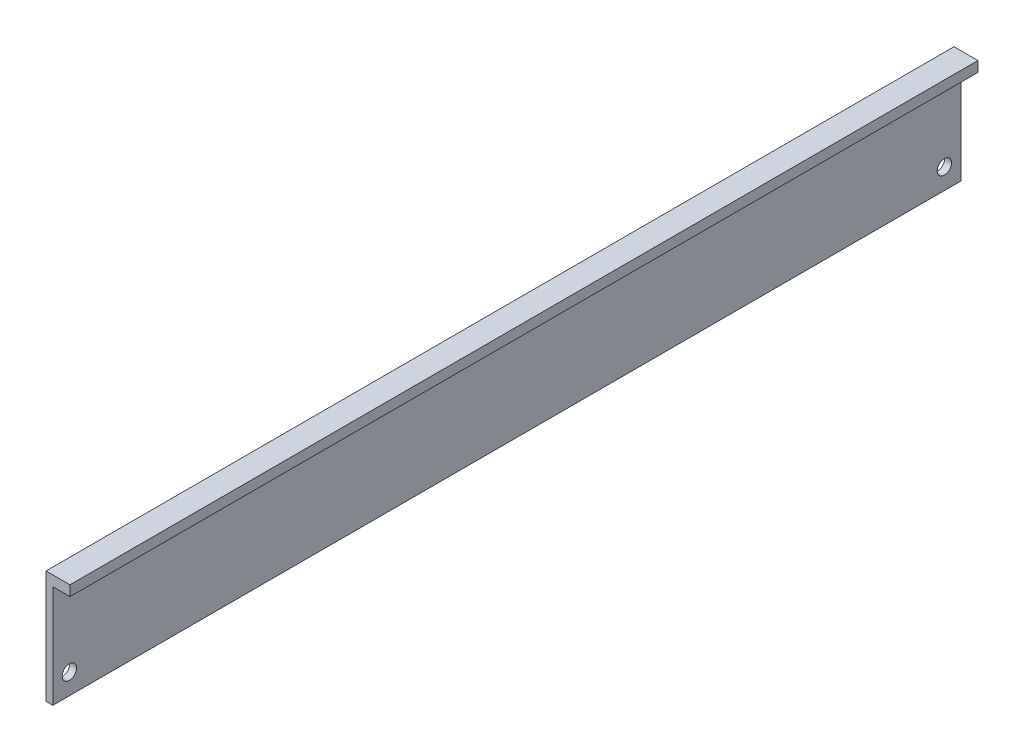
SolidWorks part; units mm, degrees
ref_plane "前视基准面" through (0, 0, 0) normal (0, 0, 1) x (1, 0, 0)
ref_plane "上视基准面" through (0, 0, 0) normal (0, 1, 0) x (1, 0, 0)
ref_plane "右视基准面" through (0, 0, 0) normal (1, 0, 0) x (0, 0, -1)
ref_plane "基准面1" through (4153.3665, 0, 0) normal (1, 0, 0) x (0, 0, -1)
sketch "草图1" plane through (4153.3665, 0, 0) normal (1, 0, 0) x (0, 0, -1)
  line L0 (132, 1662.2659) -> (132, 1695.2659)
  line L1 (132, 1695.2659) -> (0, 1695.2659)
  line L2 (0, 1695.2659) -> (0, 1662.2659)
  line L3 (0, 1662.2659) -> (132, 1662.2659)
extrude "凸台-拉伸1" add sketch "草图1" against normal blind 7
sketch "草图2" plane through (0, 0, -132) normal (0, 0, -1) x (-1, 0, 0)
  line L0 (-4148.3665, 1692.2659) -> (-4153.3665, 1692.2659)
  line L1 (-4153.3665, 1692.2659) -> (-4153.3665, 1662.2659)
  line L2 (-4153.3665, 1662.2659) -> (-4148.3665, 1662.2659)
  line L3 (-4148.3665, 1662.2659) -> (-4148.3665, 1692.2659)
extrude "切除-拉伸1" cut sketch "草图2" against normal through all
hole_wizard "Ø4.2 (4.2) 直径孔1" positions "草图4" profile "草图3" hole size "Ø4.2" standard "ANSI Metric"
sketch "草图4" plane through (4146.3665, 0, 0) normal (-1, 0, 0) x (0, 0, 1)
  point P0 (-127.175, 1668.2659)
sketch "草图3" plane through (4146.3665, 1668.2659, -127.175) normal (0, 1, 0) x (0, 0, 1)
  line L0 (0, 0) -> (0, 7)
  line L1 (0, 7) -> (2.1, 7)
  line L2 (2.1, 7) -> (2.1, 0)
  line L5 (2.1, 0) -> (0, 0)
  line L11 (0, -6.35) -> (0, 107.95) construction
  dimension "通孔孔直径" = 4.2
  dimension "通孔孔深度" = 7
sketch "草图5" plane through (0, 0, 0) normal (0, 0, 1) x (1, 0, 0)
  line L6 (4148.3665, 1662.2659) -> (4148.3665, 1692.2659)
  line L7 (4148.3665, 1692.2659) -> (4153.3665, 1692.2659)
  line L8 (4153.3665, 1692.2659) -> (4153.3665, 1695.2659)
  line L9 (4153.3665, 1695.2659) -> (4146.3665, 1695.2659)
  line L10 (4146.3665, 1695.2659) -> (4146.3665, 1662.2659)
  line L11 (4146.3665, 1662.2659) -> (4148.3665, 1662.2659)
  line L12 (4148.3665, 1662.2659) -> (4148.3665, 1692.2659)
  line L13 (4148.3665, 1692.2659) -> (4153.3665, 1692.2659)
  line L14 (4153.3665, 1692.2659) -> (4153.3665, 1695.2659)
  line L15 (4153.3665, 1695.2659) -> (4146.3665, 1695.2659)
  line L16 (4146.3665, 1695.2659) -> (4146.3665, 1662.2659)
  line L17 (4146.3665, 1662.2659) -> (4148.3665, 1662.2659)
  dimension "D1" = 0
extrude "凸台-拉伸2" add sketch "草图5" along normal blind 133.35
sketch "草图6" plane through (4146.3665, 0, 0) normal (-1, 0, 0) x (0, 0, 1)
  line L0 (0.675, 1662.2659) -> (0.675, 1689.8942) construction
  line L1 (133.35, 1662.2659) -> (-132, 1662.2659) construction
  line L2 (133.35, 1695.2659) -> (133.35, 1662.2659) construction
  circle A0 centre (128.52, 1668.2659) radius 2.1
  circle A1 centre (-127.175, 1668.2659) radius 2.1
  dimension "D1" = 4.83
  dimension "D2" = 6
extrude "切除-拉伸2" cut sketch "草图6" against normal through all
